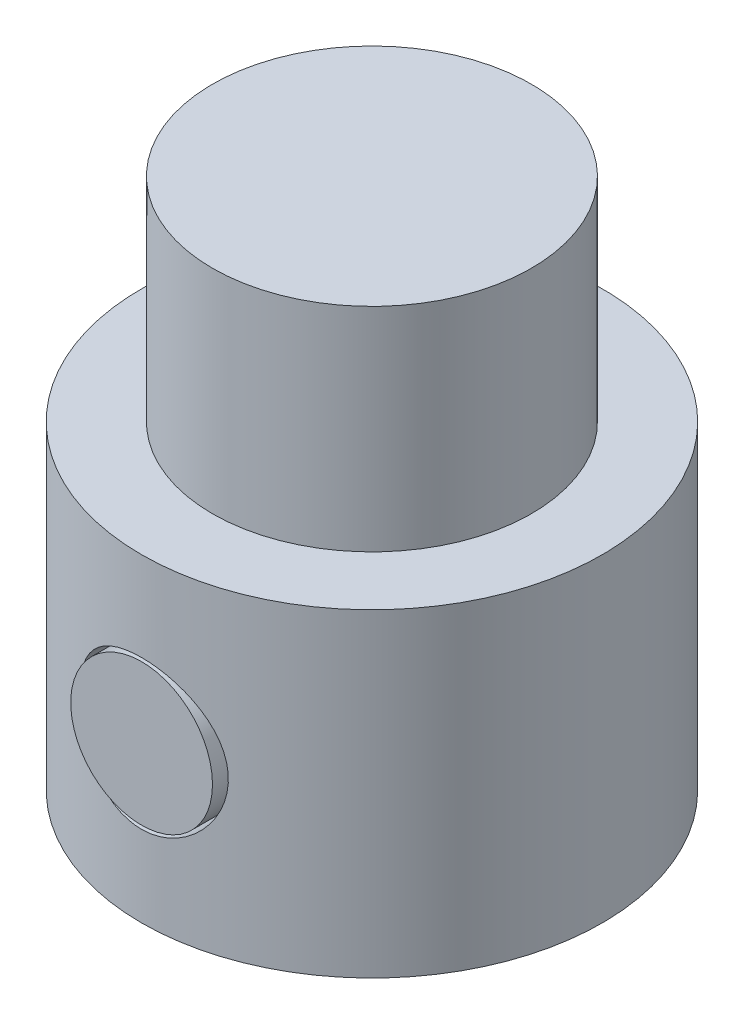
SolidWorks part; units mm, degrees
ref_plane "Alzado" through (0, 0, 0) normal (0, 0, 1) x (1, 0, 0)
ref_plane "Planta" through (0, 0, 0) normal (0, 1, 0) x (1, 0, 0)
ref_plane "Vista lateral" through (0, 0, 0) normal (1, 0, 0) x (0, 0, -1)
sketch "Croquis1" plane through (0, 0, 0) normal (0, 1, 0) x (1, 0, 0)
  circle A0 centre (0, 0) radius 6.5
  dimension "D1" = 13
extrude "Saliente-Extruir1" add sketch "Croquis1" along normal blind 9
sketch "Croquis2" plane through (0, 9, 0) normal (0, 1, 0) x (1, 0, 0)
  circle A0 centre (0, 0) radius 4.5
  dimension "D1" = 9
extrude "Saliente-Extruir2" add sketch "Croquis2" along normal blind 6
sketch "Croquis3" plane through (0, 0, 0) normal (0, 0, 1) x (1, 0, 0)
  circle A0 centre (0, 4.3881) radius 2.1
  dimension "D1" = 4.2
extrude "Cortar-Extruir1" cut sketch "Croquis3" along normal blind 9
sketch "Croquis4" plane through (0, 0, 0) normal (0, 0, 1) x (1, 0, 0)
  circle A0 centre (0, 4.3881) radius 2
  dimension "D1" = 4
extrude "Saliente-Extruir3" add sketch "Croquis4" along normal through all
